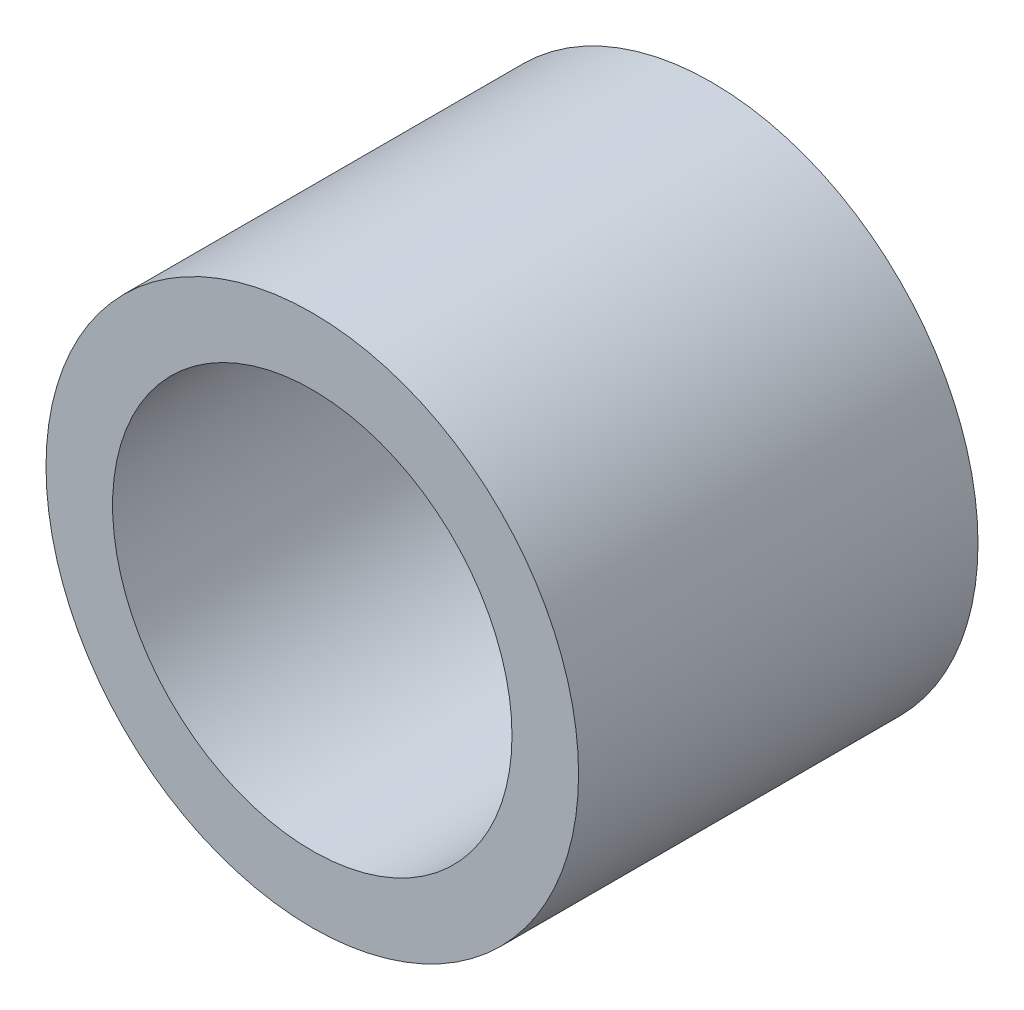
SolidWorks part; units mm, degrees
ref_plane "前视基准面" through (0, 0, 0) normal (0, 0, 1) x (1, 0, 0)
ref_plane "上视基准面" through (0, 0, 0) normal (0, 1, 0) x (1, 0, 0)
ref_plane "右视基准面" through (0, 0, 0) normal (1, 0, 0) x (0, 0, -1)
sketch "草图1" plane through (0, 0, 0) normal (0, 0, 1) x (1, 0, 0)
  circle A0 centre (0, 0) radius 15
  circle A1 centre (0, 0) radius 20
  dimension "D1" = 30
  dimension "D2" = 40
extrude "拉伸1" add sketch "草图1" along normal blind 30
